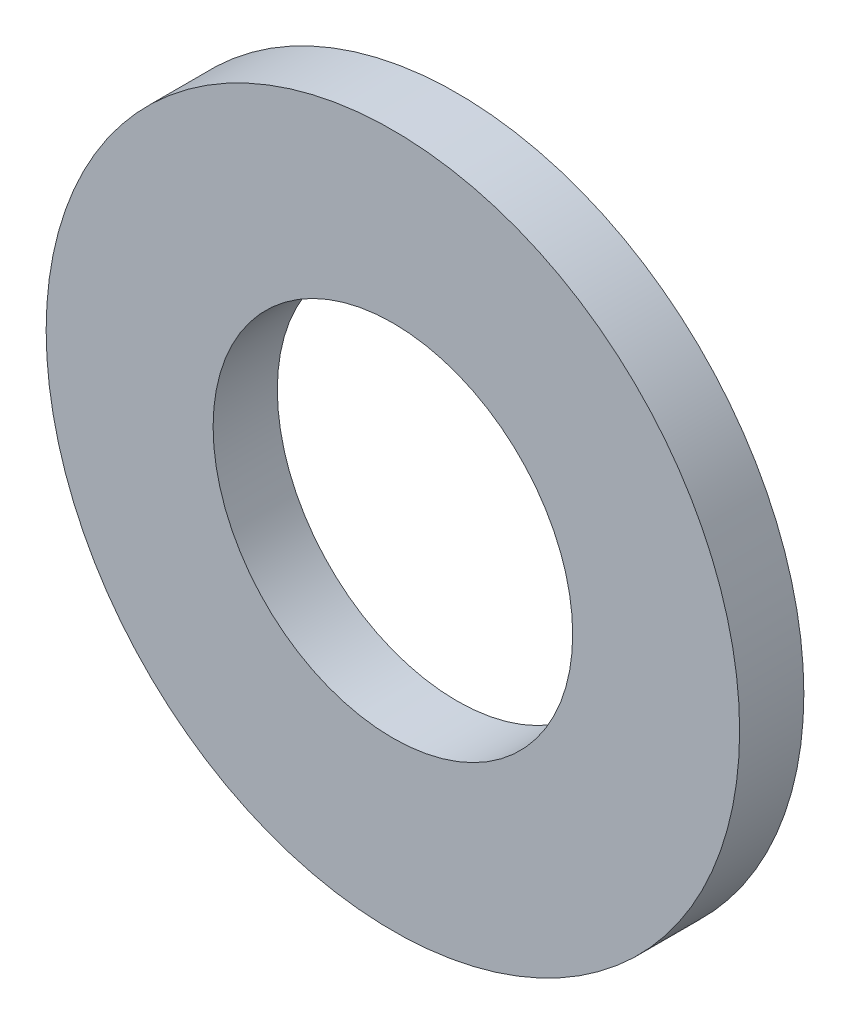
SolidWorks part; units mm, degrees
ref_plane "Plan de face" through (0, 0, 0) normal (0, 0, 1) x (1, 0, 0)
ref_plane "Plan de dessus" through (0, 0, 0) normal (0, 1, 0) x (1, 0, 0)
ref_plane "Plan de droite" through (0, 0, 0) normal (1, 0, 0) x (0, 0, -1)
sketch "Esquisse1" plane through (0, 0, 0) normal (0, 1, 0) x (1, 0, 0)
  line L0 (7, -2.5) -> (13.5, -2.5)
  line L1 (13.5, -2.5) -> (13.5, 0)
  line L2 (13.5, 0) -> (7, 0)
  line L3 (7, 0) -> (7, -2.5)
  line L4 (0, 0) -> (0, -2.5) construction
revolve "Révolution1" add sketch "Esquisse1" angle 360 about L4
